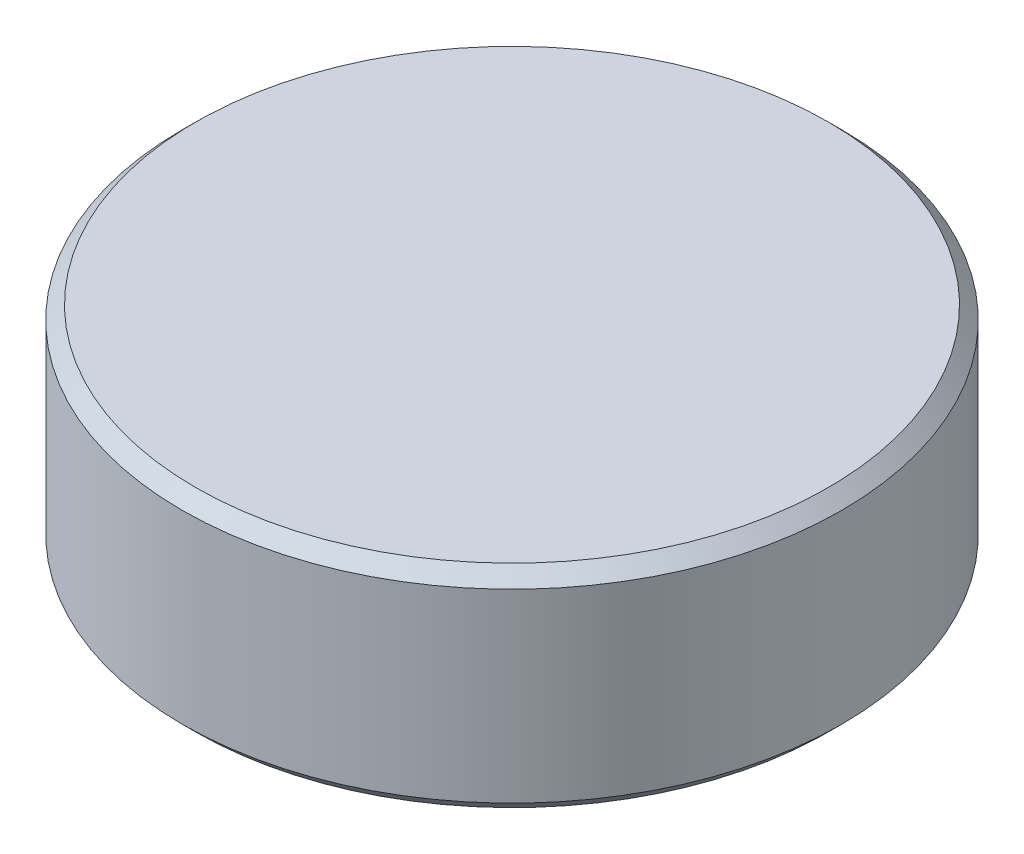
SolidWorks part; units mm, degrees
ref_plane "Front Plane" through (0, 0, 0) normal (0, 0, 1) x (1, 0, 0)
ref_plane "Top Plane" through (0, 0, 0) normal (0, 1, 0) x (1, 0, 0)
ref_plane "Right Plane" through (0, 0, 0) normal (1, 0, 0) x (0, 0, -1)
sketch "Sketch1" plane through (0, 0, 0) normal (0, 1, 0) x (1, 0, 0)
  circle A0 centre (0, 0) radius 7.475
  circle A1 centre (0, 0) radius 10.2
  circle A2 centre (0, 0) radius 12.2
  dimension "D1" = 14.95
  dimension "D2" = 20.4
  dimension "D3" = 24.4
extrude "Boss-Extrude1" add sketch "Sketch1" along normal blind 4 contours A0
sketch "Sketch2" plane through (0, 0, 0) normal (0, 1, 0) x (1, 0, 0)
  circle A0 centre (0, 0) radius 10.15
  circle A1 centre (0, 0) radius 12.15
  dimension "D1" = 20.3
  dimension "D2" = 24.3
extrude "Boss-Extrude2" add sketch "Sketch2" along normal blind 4 separate body
sketch "Sketch3" plane through (0, 4, 0) normal (0, 1, 0) x (1, 0, 0)
  circle A0 centre (0, 0) radius 12.2
extrude "Boss-Extrude3" add sketch "Sketch3" along normal blind 0.8
sketch "Sketch4" plane through (0, 0, 0) normal (0, -1, 0) x (1, 0, 0)
  circle A0 centre (0, 0) radius 7.475
  circle A1 centre (0, 0) radius 15.7633
extrude "Cut-Extrude1" cut sketch "Sketch4" against normal through all
sketch "Sketch5" plane through (0, 0, 0) normal (0, -1, 0) x (1, 0, 0)
  circle A0 centre (0, 0) radius 1.5
  dimension "D1" = 3
extrude "Boss-Extrude4" add sketch "Sketch5" along normal blind 1
chamfer "Chamfer1" distance 0.3 angle 45 2 edges at (0, 4.8, -7.475) (0, 0, 7.475)
